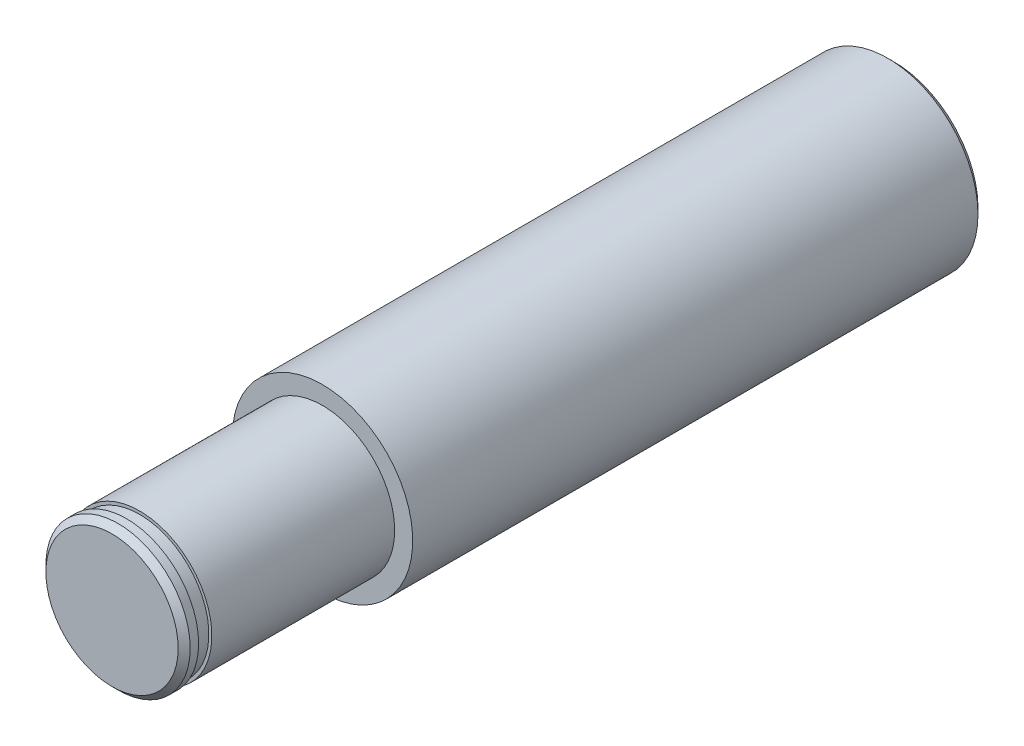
SolidWorks part; units mm, degrees
ref_plane "Face" through (0, 0, 0) normal (0, 0, 1) x (1, 0, 0)
ref_plane "Dessus" through (0, 0, 0) normal (0, 1, 0) x (1, 0, 0)
ref_plane "Droite" through (0, 0, 0) normal (1, 0, 0) x (0, 0, -1)
sketch "Esquisse1" plane through (0, 0, 0) normal (0, 0, 1) x (1, 0, 0)
  circle A0 centre (0, 0) radius 7.5
  dimension "D1" = 15
extrude "Extrusion1" add sketch "Esquisse1" along normal blind 65
chamfer "Chanfrein1" distance 0.5 angle 45
sketch "Esquisse3" plane through (0, 0, 0) normal (1, 0, 0) x (0, 0, -1)
  line L0 (0, 0) -> (-11.4583, 0) construction
  line L1 (-65, 11.7147) -> (-47.5, 11.7147)
  line L2 (-65, 11.7147) -> (-65, 6)
  line L3 (-65, 6) -> (-47.5, 6)
  line L4 (-47.5, 11.7147) -> (-47.5, 6)
  line L5 (-65, 7.5) -> (-65, -7.5) construction
  dimension "D1" = 47.5
  dimension "D2" = 6
revolve "Enlèvement de matière-Révolution2" cut sketch "Esquisse3" angle 360 about L0
sketch "Esquisse2" plane through (0, 0, 0) normal (1, 0, 0) x (0, 0, -1)
  line L0 (0, 0) -> (-14.0417, 0) construction
  line L1 (-63.8, 10) -> (-62.7, 10)
  line L2 (-63.8, 10) -> (-63.8, 5.75)
  line L3 (-63.8, 5.75) -> (-62.7, 5.75)
  line L4 (-62.7, 10) -> (-62.7, 5.75)
  line L5 (-47.5, 7.5) -> (-47.5, -7.5) construction
  dimension "D1" = 5.75
  dimension "D2" = 1.1
  dimension "D3" = 15.2
revolve "Enlèvement de matière-Révolution1" cut sketch "Esquisse2" angle 360 about L0
chamfer "Chanfrein2" distance 0.5 angle 45
